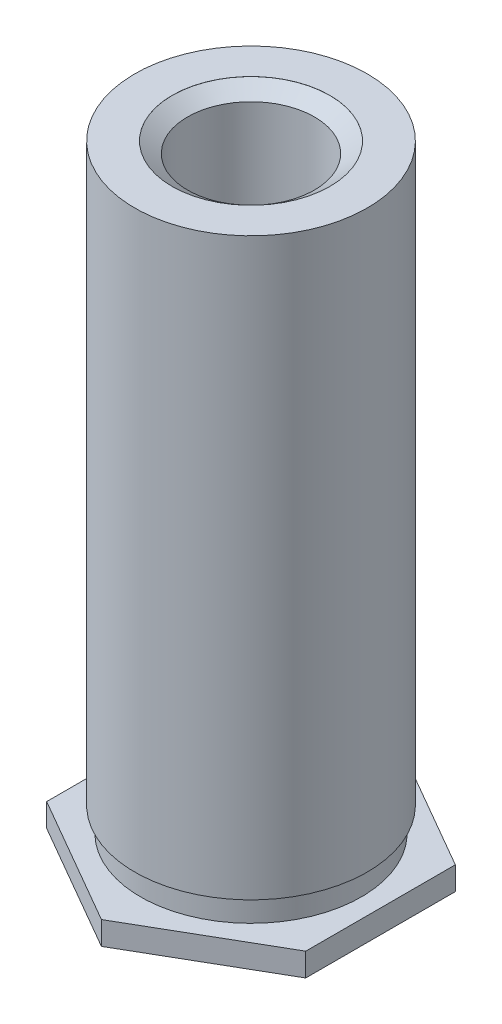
SolidWorks part; units mm, degrees
ref_plane "Plane1" through (0, 0, 0) normal (0, 0, 1) x (1, 0, 0)
ref_plane "Plane2" through (0, 0, 0) normal (0, 1, 0) x (1, 0, 0)
ref_plane "Plane3" through (0, 0, 0) normal (1, 0, 0) x (0, 0, -1)
sketch "BodySke" plane through (0, 0, 0) normal (0, 0, 1) x (1, 0, 0)
  line L0 (3.556, 0) -> (4.5964, 0)
  line L1 (4.5964, 0) -> (4.5964, 0.7112)
  line L2 (4.5964, 0.7112) -> (3.3782, 0.7112)
  line L3 (1.9406, 19.05) -> (1.9406, 9.525)
  line L4 (3.556, 1.458) -> (3.3782, 1.458)
  line L5 (3.3782, 1.458) -> (3.3782, 0.7112)
  line L6 (3.556, 0.0025) -> (3.556, 0)
  line L7 (1.016, 18.2575) -> (3.6522, 18.2575) construction
  line L8 (3.556, 19.05) -> (1.9406, 19.05)
  line L9 (0, 0) -> (0, 15.24) construction
  line L10 (3.556, 0.0025) -> (0, 0.0025)
  line L11 (3.556, 19.05) -> (3.556, 1.458)
  line L12 (0, 9.525) -> (1.9406, 9.525)
  line L13 (0, 9.525) -> (0, 0.0025)
  line L14 (1.016, 9.525) -> (3.6522, 9.525) construction
  line L15 (1.016, 9.525) -> (3.6522, 9.525) construction
  dimension "D1" = 0.0025
  dimension "E_dia" = 9.1928
  dimension "C_dia" = 7.112
  dimension "Thread_min" = 3.8811
  dimension "Clinching_ht" = 0.7112
  dimension "Advance" = 0.7925
  dimension "Length" = 19.05
  dimension "Thread_limit" = 9.525
  dimension "Thread_depth" = 9.525
  dimension "Drill_depth" = 9.525
  dimension "Groove_wid" = 0.7468
  dimension "Groove_dia" = 6.7564
revolve "Body" add sketch "BodySke"
revolve "EndChamfer" cut sketch "EndChamferSke" angle 360 about L0
sketch "EndChamferSke" plane through (0, 0, 0) normal (0, 0, 1) x (1, 0, 0)
  line L0 (0, -2.54) -> (0, 7.62) construction
  line L1 (0, 0) -> (0, 15.24) construction
  line L6 (2.413, 19.0475) -> (1.9406, 18.7168)
  line L7 (2.413, 19.0475) -> (2.413, 19.304)
  line L8 (1.9406, 18.7168) -> (1.9406, 19.304)
  line L9 (2.413, 19.304) -> (1.9406, 19.304)
  line L10 (3.556, 19.05) -> (-3.556, 19.05) construction
  dimension "D1" = 0.254
  dimension "Thread_nominal" = 4.826
  dimension "D2" = 34.99
  dimension "Thread_min" = 3.8811
  dimension "Inset" = 0.0025
revolve "TapDrill" cut sketch "TapDriSke" angle 360 about L0
sketch "TapDriSke" plane through (0, 0, 0) normal (0, 0, 1) x (1, 0, 0)
  line L0 (0, 0) -> (0, 15.24) construction
  line L1 (0, 0) -> (0, 15.24) construction
  line L2 (1.9406, 5.5626) -> (1.9406, 19.05)
  line L3 (3.556, 19.05) -> (-3.556, 19.05) construction
  line L4 (1.9406, 5.5626) -> (0, 4.7588)
  line L5 (0, 4.7588) -> (0, 19.05)
  line L6 (0, 19.05) -> (1.9406, 19.05)
  line L7 (1.9406, 9.525) -> (1.9406, 19.05) construction
  line L8 (0, 4.7588) -> (-1.9406, 5.5626) construction
  line L9 (-1.9406, 19.05) -> (-1.9406, 9.525) construction
  line L10 (0, 1.458) -> (4.826, 1.458) construction
  dimension "D1" = 135
  dimension "Depth" = 13.4874
  dimension "Drill_limit" = 17.592
ref_plane "Plane4" through (0, -0.5486, 0) normal (0, 1, 0) x (-1, 0, 0)
sketch "ThdSchSke" plane through (0, 0, 0) normal (0, 0, 1) x (1, 0, 0)
  line L0 (0, -5.08) -> (0, 7.62) construction
  line L1 (0, 0) -> (0, 15.24) construction
  line L2 (0, 19.0475) -> (2.413, 19.0475) construction
  line L3 (2.413, 19.0475) -> (-2.413, 19.0475) construction
  line L4 (2.413, 19.0475) -> (1.9406, 19.3783)
  line L6 (2.413, 19.0475) -> (1.9406, 18.7167)
  line L7 (1.9406, 19.3783) -> (1.9406, 18.7167)
  dimension "Vee_angle" = 70
  dimension "Thread_nominal" = 4.826
  dimension "Thread_min" = 3.8811
revolve "ThreadSchematic" [suppressed] cut sketch "ThdSchSke" angle 360 about L0
pattern_linear "ThdSchPat" [suppressed]
sketch "HexDieSke" plane through (0, 0.7112, 0) normal (0, 1, 0) x (-1, 0, 0)
  line L0 (0, 4.5754) -> (3.9624, 2.2877)
  line L1 (3.9624, 2.2877) -> (3.9624, -2.2877)
  line L2 (3.9624, -2.2877) -> (0, -4.5754)
  line L3 (0, -4.5754) -> (-3.9624, -2.2877)
  line L4 (-3.9624, -2.2877) -> (-3.9624, 2.2877)
  line L5 (-3.9624, 2.2877) -> (0, 4.5754)
  circle A1 centre (0, 0) radius 3.9624 construction
  circle A2 centre (0, 0) radius 4.5754 construction
  circle A3 centre (0, 0) radius 4.6091
  dimension "Width_across_flats" = 7.9248
  dimension "OD" = 9.2182
extrude "HexDie" cut sketch "HexDieSke" against normal blind 0.7112
equation "' \"Length@BodySke\" = 0.75"
equation "' \"C_dia@BodySke\" = 0.28"
equation "' \"Width_across_flats@HexDieSke\" = 0.312"
equation "' \"Thread_depth@BodySke\" = 0.375"
equation "' \"Advance@BodySke\" = 0.0312"
equation "' \"Thread_min@BodySke\" = 0.1528"
equation "' \"Thread_nominal@ThreadCosmetic\" = 0.19"
equation "\"E_dia@BodySke\" = \"Width_across_flats@HexDieSke\" * 1.16"
equation "\"Clinching_ht@BodySke\" = \"C_dia@BodySke\" * 0.1"
equation "\"Groove_dia@BodySke\" = \"C_dia@BodySke\" * 0.95"
equation "\"Groove_wid@BodySke\" = \"Clinching_ht@BodySke\" * 1.05"
equation "\"Drill_depth@BodySke\" = \"Thread_depth@BodySke\""
equation "\"Drill_limit@TapDriSke\" = \"Length@BodySke\" - \"Clinching_ht@BodySke\" - \"Groove_wid@BodySke\""
equation "\"Thread_limit@BodySke\" = ((sgn( \"Length@BodySke\" - \"Thread_depth@BodySke\" )-1)*( \"Length@BodySke\" - \"Thread_depth@BodySke\" ))/-2+ \"Thread_depth@BodySke\""
equation "\"Depth@TapDriSke\" = \"Thread_limit@BodySke\" + \"Advance@BodySke\" * 5"
equation "\"Depth@TapDriSke\" = ((sgn( \"Depth@TapDriSke\" - \"Drill_limit@TapDriSke\" )-1)*( \"Depth@TapDriSke\" - \"Drill_limit@TapDriSke\" ))/-2+ \"Drill_limit@TapDriSke\""
equation "\"Depth@HexDie\" = \"Clinching_ht@BodySke\""
equation "\"OD@HexDieSke\" =  \"Width_across_flats@HexDieSke\" * 1.16 + 0.001"
equation "\"Thread_nominal@EndChamferSke\" = \"Thread_nominal@ThreadCosmetic\""
equation "\"Thread_min@EndChamferSke\" = \"Thread_min@BodySke\""
equation "\"D2@EndChamferSke\" = \"Vee_angle@ThdSchSke\" / 2 - 0.01"
equation "\"Thread_nominal@ThdSchSke\" = \"Thread_nominal@ThreadCosmetic\""
equation "\"Thread_min@ThdSchSke\" = \"Thread_min@BodySke\""
equation "\"Num_threads@ThdSchPat\" = int(  ( \"Thread_limit@BodySke\" - \"Inset@EndChamferSke\" ) / \"Advance@BodySke\" + 0.999 )  + 1"
equation "\"Advance@ThdSchPat\" = (  \"Thread_limit@BodySke\" - \"Inset@EndChamferSke\" ) /  (\"Num_threads@ThdSchPat\" - 1) 'relax it"
